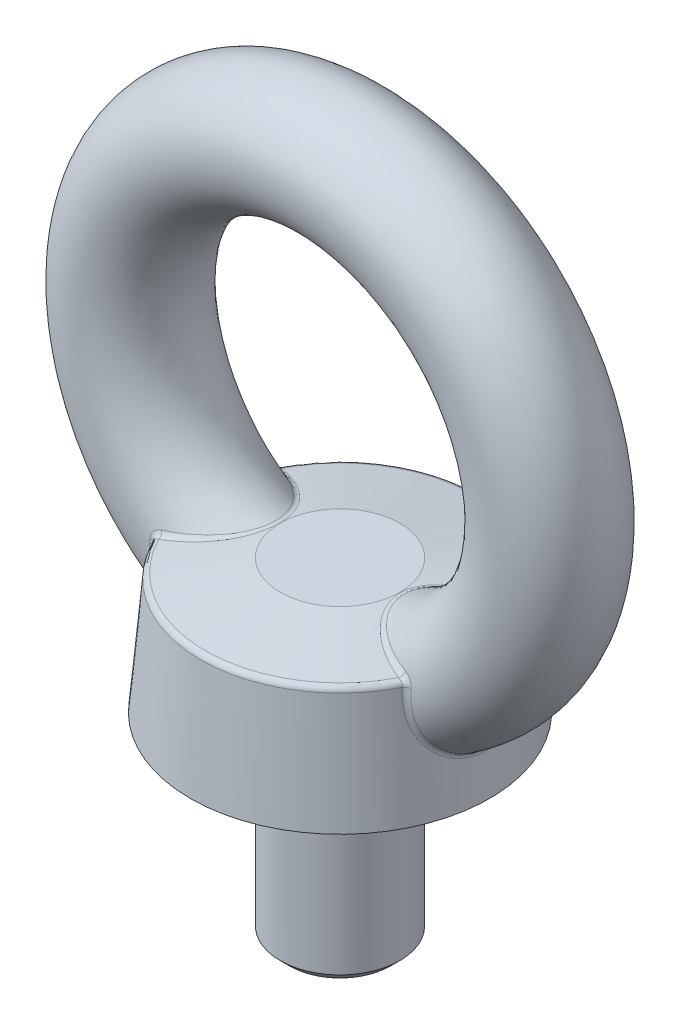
SolidWorks part; units mm, degrees
ref_plane "Front Plane" through (0, 0, 0) normal (0, 0, 1) x (1, 0, 0)
ref_plane "Top Plane" through (0, 0, 0) normal (0, 1, 0) x (1, 0, 0)
ref_plane "Right Plane" through (0, 0, 0) normal (1, 0, 0) x (0, 0, -1)
sketch "Sketch1" plane through (0, 0, 0) normal (0, 0, 1) x (1, 0, 0)
  ellipse E0 centre (0, 18) end of major axis (0, 0) minor radius 18
  dimension "D1" = 36
  dimension "D2" = 36
sketch "Sketch2" plane through (0, 0, 0) normal (1, 0, 0) x (0, 0, -1)
  line L3 (0, 36) -> (0, 0) construction
  circle A0 centre (0, 4) radius 4
  point P5 (0, 0)
sweep "Sweep1" add profiles "Sketch2" path "Sketch1"
sketch "Sketch3" plane through (0, 0, 0) normal (1, 0, 0) x (0, 0, -1)
  line L0 (0, 0) -> (-10, 0)
  line L1 (-10, 0) -> (-9.3001, 8)
  line L2 (-9.3001, 8) -> (-4, 8.9345)
  line L3 (-4, 8.9345) -> (0, 8.9345)
  line L4 (0, 8.9345) -> (0, 0)
revolve "Revolve1" add sketch "Sketch3" angle 360 about L4
fillet "Fillet1" radius 0.4 6 edges at (4.1887, 8.898, 0.3951) (9.7359, 2.8924, -0.4643) (-4.1887, 8.898, -0.3951) (-9.7395, 2.8859, -0.3952) (0, 8, -9.3001) (0, 8, 9.3001)
sketch "Sketch4" plane through (0, 0, 0) normal (0, -1, 0) x (1, 0, 0)
  circle A0 centre (0, 0) radius 4
  dimension "D1" = 8
extrude "Extrude1" add sketch "Sketch4" along normal blind 13
chamfer "Chamfer1" distance 0.62 angle 45 1 edges at (0, -13, -4)
sketch "Sketch5" plane through (0, 0, 0) normal (1, 0, 0) x (0, 0, -1)
  line L0 (-4, 0) -> (-4, -1.6939)
  line L1 (-4, 0) -> (-4, -12.38) construction
  line L2 (-3.38, -0.62) -> (-4, -1.6939)
  line L3 (-3.38, -0.62) -> (-3.38, -0.31)
  line L4 (-3.69, 0) -> (-4, 0)
  line L5 (-3.69, -0.31) -> (-3.38, -0.31) construction
  arc A1 (-3.38, -0.31) -> (-3.69, 0) centre (-3.69, -0.31) ccw
  point P0 (-3.38, -13)
  dimension "D1" = 30
revolve "Cut-Revolve1" cut sketch "Sketch5" angle 360 about axis through (0, -13, 0) along (0, 1, 0)
equation "\"D4@Sketch3\" = \"D1@Sketch2\""
equation "\"D5@Sketch3\" = \"D1@Sketch2\"/2"
